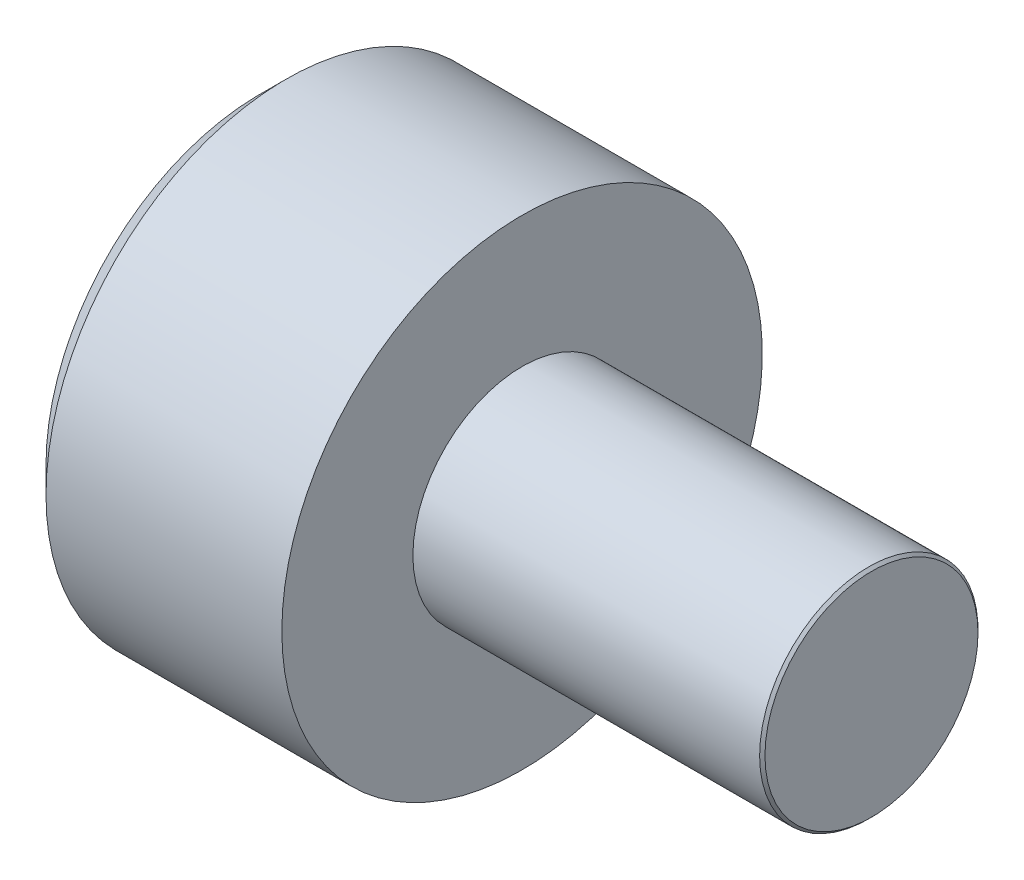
SolidWorks part; units mm, degrees
ref_plane "Plane1" through (0, 0, 0) normal (0, 0, 1) x (1, 0, 0)
ref_plane "Plane2" through (0, 0, 0) normal (0, 1, 0) x (1, 0, 0)
ref_plane "Plane3" through (0, 0, 0) normal (1, 0, 0) x (0, 0, -1)
sketch "BodySke" plane through (0, 0, 0) normal (0, 0, 1) x (1, 0, 0)
  line L0 (0, 0) -> (0, 2.45)
  line L1 (0.3, 2.75) -> (3, 2.75)
  line L2 (3, 2.75) -> (3, 1.25)
  line L3 (3, 1.25) -> (6.9695, 1.25)
  line L4 (7, 1.2195) -> (7, 0)
  line L5 (7, 0) -> (0, 0)
  line L6 (-5.3053, 0) -> (21.9353, 0) construction
  line L7 (0, 2.45) -> (0.3, 2.75)
  line L8 (7, 1.2195) -> (6.9695, 1.25)
  line L9 (0, -2.45) -> (0.3, -2.75) construction
  line L10 (7, -1.2195) -> (6.9695, -1.25) construction
  line L11 (3.5, 9.525) -> (3.5, 3.175) construction
  line L12 (3, 9.525) -> (3, 3.175) construction
  line L13 (-43, 9.525) -> (-43, 3.175) construction
revolve "Base-Revolve" add sketch "BodySke" angle 360 about L6
sketch "Sketch2" plane through (0, 0, 0) normal (0, 0, 1) x (1, 0, 0)
  line L0 (0, 1.28) -> (1.3, 1.28)
  line L1 (1.3, 1.28) -> (2.039, 0)
  line L2 (-5.3053, 0) -> (21.9353, 0) construction
  line L3 (2.039, 0) -> (0, 0)
  line L4 (0, 0) -> (0, 1.28)
  line L5 (0, 2.45) -> (0, -2.45) construction
  line L6 (0, 0) -> (47.625, 0) construction
  line L7 (3, -2.75) -> (3, 2.75) construction
revolve "Hex-PreBroach" cut sketch "Sketch2" angle 360 about L6
sketch "Sketch3" plane through (0, 0, 0) normal (-1, 0, 0) x (0, 0.5, 0.866)
  line L0 (0.739, 1.28) -> (-0.739, 1.28)
  line L1 (-0.739, 1.28) -> (-1.478, 0)
  line L2 (0.739, 1.28) -> (1.478, 0)
  line L3 (0.739, -1.28) -> (1.478, 0)
  line L4 (0.739, -1.28) -> (-0.739, -1.28)
  line L5 (-0.739, -1.28) -> (-1.478, 0)
extrude "Hex" cut sketch "Sketch3" against normal blind 1.3
sketch "Sketch4" plane through (0, 0, 0) normal (-1, 0, 0) x (0, 0, 1)
  line L0 (0, 0) -> (1.4605, 0)
  line L1 (0, 0) -> (6.1484, 3.5498) construction
  line L2 (0, 0) -> (0.7302, 1.2648)
  line L3 (1.2009, 0.3267) -> (1.3933, 0.4378)
  line L4 (0.8834, 0.8767) -> (1.0758, 0.9877)
  arc A0 (1.2009, 0.3267) -> (0.8834, 0.8767) centre (0, 0) ccw
  arc A1 (1.4605, 0) -> (1.3933, 0.4378) centre (0, 0) ccw
  arc A2 (0.7302, 1.2648) -> (1.0758, 0.9877) centre (0, 0) cw
extrude "Spline" [suppressed] cut sketch "Sketch4" against normal blind 1.3
pattern_circular "CirPattern1" [suppressed] count 6 every 60 about axis through (-5.3053, 0, 0) along (1, 0, 0)
sketch "Sketch5" plane through (0, 0, 0) normal (0, 0, 1) x (1, 0, 0)
  line L0 (-5.3053, 0) -> (21.9353, 0) construction
  line L2 (0, 2.45) -> (0, -2.45) construction
  circle A0 centre (1.2, 0) radius 0.475
  dimension "Drilled_hole_dia" = 0.95
  dimension "Drilled_hole_loc" = 1.2
extrude "Hole" [suppressed] cut sketch "Sketch5" against normal through all and the other way through all
pattern_circular "Drilled-4" [suppressed] count 2 every 60 about axis through (-5.3053, 0, 0) along (1, 0, 0)
pattern_circular "Drilled-6" [suppressed] count 3 every 60 about axis through (-5.3053, 0, 0) along (1, 0, 0)
sketch "ThdSchSke" plane through (0, 0, 0) normal (0, 0, 1) x (1, 0, 0)
  line L0 (3.5, -1.2195) -> (3.4786, -1.25)
  line L1 (3.5, -1.2195) -> (3.5214, -1.25)
  line L2 (3.5214, -1.25) -> (3.5214, -1.5625)
  line L3 (-3.175, 0) -> (5.1513, 0) construction
  line L5 (3.5214, -1.5625) -> (3.4786, -1.5625)
  line L6 (3.4786, -1.5625) -> (3.4786, -1.25)
  line L7 (0, 2.45) -> (0, -2.45) construction
revolve "ThreadSchematic" [suppressed] cut sketch "ThdSchSke" angle 360 about L3
pattern_linear "ThdSchPat" [suppressed]
equation "\"D2@Sketch3\" = \"Hex_size@Sketch3\" / 2"
equation "\"D1@Sketch3\" = \"Hex_size@Sketch3\" / 2"
equation "\"D1@Sketch2\" = \"Hex_size@Sketch3\" / 2"
equation "\"D3@Sketch4\" = \"Spline_p_dim@Sketch4\" / 2"
equation "\"Thread_minor@ThreadCosmetic\"  =  \"Minor_dia@BodySke\""
equation "\"D2@CirPattern1\" = 360 / \"Num_teeth@CirPattern1\""
equation "\"Wall_thickness@Sketch2\" = \"Head_ht@BodySke\" - \"Key_eng@Hex\""
equation "\"Thread_length@ThreadCosmetic\" = ((sgn( (\"Length@BodySke\" - \"Advance@BodySke\" ) - \"Thread_nom@BodySke\" )-1)*( (\"Length@BodySke\" - \"Advance@BodySke\" ) - \"Thread_nom@BodySke\" ))/-2+ \"Thread_nom@BodySke\""
equation "\"Thread_minor@ThdSchSke\" = \"Minor_dia@BodySke\""
equation "\"Diameter@ThdSchSke\" = \"Diameter@BodySke\""
equation "\"Overcut@ThdSchSke\" = \"Diameter@BodySke\" * 1.25"
equation "\"Start@ThdSchSke\" = \"Head_ht@BodySke\" + \"Length@BodySke\" - \"Thread_length@ThreadCosmetic\"  '---Non-countersunk---"
equation "\"Num_threads@ThdSchPat\" = int( \"Thread_length@ThreadCosmetic\" / \"Advance@BodySke\" + 0.999 )  + 1"
equation "\"Advance@ThdSchPat\" = \"Thread_length@ThreadCosmetic\" /  (\"Num_threads@ThdSchPat\" - 1) 'relax it"
equation "\"Num_threads@ThdSchPat\" = \"Num_threads@ThdSchPat\" - sgn( \"Num_threads@ThdSchPat\" - 1) '---chamfered tips only---"
